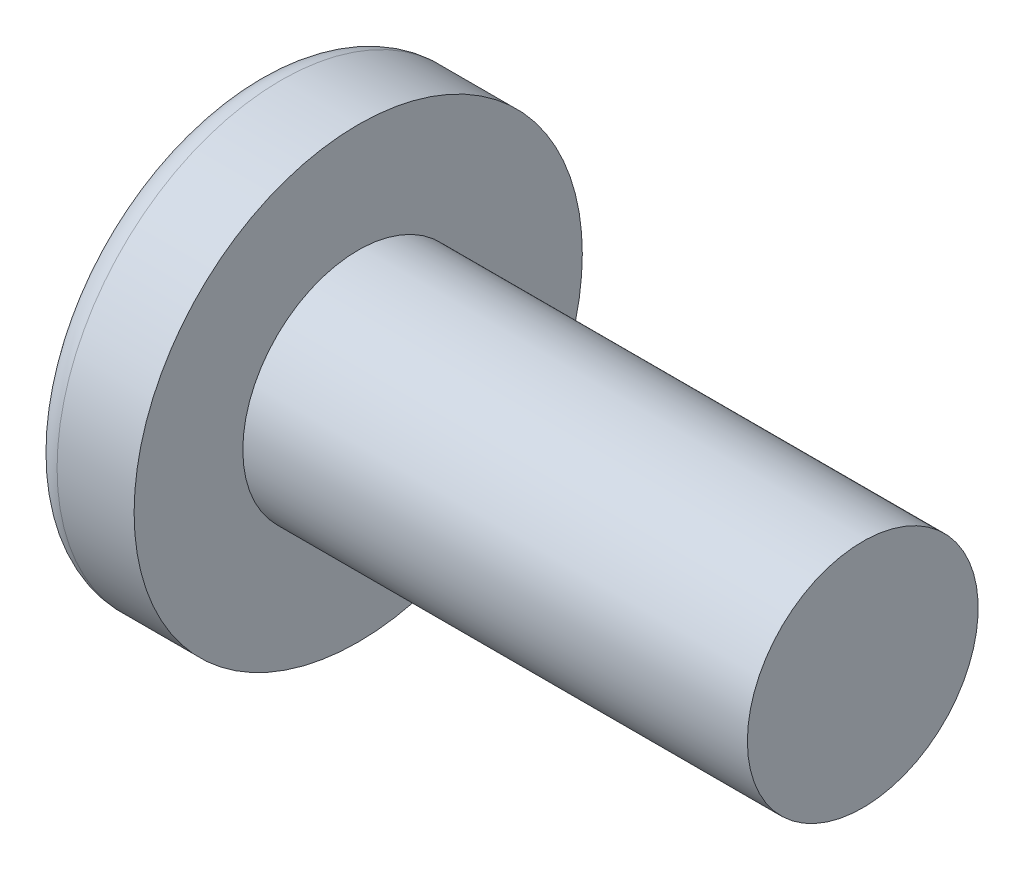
SolidWorks part; units mm, degrees
ref_plane "Plane1" through (0, 0, 0) normal (0, 0, 1) x (1, 0, 0)
ref_plane "Plane2" through (0, 0, 0) normal (0, 1, 0) x (1, 0, 0)
ref_plane "Plane3" through (0, 0, 0) normal (1, 0, 0) x (0, 0, -1)
sketch "BodySke" plane through (0, 0, 0) normal (0, 0, 1) x (1, 0, 0)
  line L0 (1.5748, 1.0922) -> (1.5748, 2.1209)
  line L1 (1.8021, 6.35) -> (1.8021, -3.175) construction
  line L2 (-25.4, 0) -> (127, 0) construction
  line L3 (6.35, 0) -> (0, 0)
  line L4 (1.5748, 1.0922) -> (6.35, 1.0922)
  line L5 (6.35, 1.0922) -> (6.35, 0)
  line L6 (0.8457, 2.1209) -> (1.5748, 2.1209)
  line L7 (1.5748, -1.0922) -> (6.35, -1.0922) construction
  line L8 (1.5748, 6.35) -> (1.5748, -3.175) construction
  arc A0 (0.6381, 2.0132) -> (0, 0) centre (3.495, 0) ccw
  arc A2 (0.6381, 2.0132) -> (0.8457, 2.1209) centre (0.8457, 1.8669) cw
  dimension "Head_fillet_rad" = 0.254
  dimension "Head_crown_rad" = 3.495
  dimension "Head_ht" = 1.5748
  dimension "Diameter" = 2.1844
  dimension "Length" = 4.7752
  dimension "Head_dia" = 4.2418
  dimension "Advance" = 0.4547
  dimension "Thread_nom" = 4.7752
revolve "Base-Revolve" add sketch "BodySke" angle 360 about L2
sketch "Sketch3" plane through (0, 0, 0) normal (1, 0, 0) x (0, 0, -1)
  line L0 (0.3429, -1.3843) -> (-0.3429, -1.3843)
  line L1 (0.3429, -1.3843) -> (0.3429, 1.3843)
  line L2 (-0.3429, 1.3843) -> (0.3429, 1.3843)
  line L3 (-0.3429, 1.3843) -> (-0.3429, -1.3843)
  dimension "D1" = 1.3843
  dimension "Cross_dia" = 2.7686
  dimension "D2" = 0.3429
  dimension "Cross_width" = 0.6858
ref_plane "Plane4" through (1.4986, 0, 0) normal (1, 0, 0) x (0, 0, -1)
sketch "Sketch4" plane through (1.4986, 0, 0) normal (1, 0, 0) x (0, 0, -1)
  line L0 (0.1715, -0.1715) -> (-0.1715, -0.1715)
  line L1 (0.1715, -0.1715) -> (0.1714, 0.1714)
  line L2 (-0.1715, 0.1714) -> (0.1714, 0.1714)
  line L3 (-0.1715, 0.1714) -> (-0.1715, -0.1715)
  dimension "D1" = 0.3429
  dimension "D2" = 0.3429
  dimension "D3" = 0.1714
  dimension "D4" = 0.1714
loft "Cut-Loft1" cut profiles "Sketch3", "Sketch4"
pattern_circular "CirPattern1" count 2 every 90 about axis through (0, 0, 0) along (1, 0, 0) of "Cut-Loft1"
sketch "ThdSchSke" plane through (0, 0, 0) normal (0, 0, 1) x (1, 0, 0)
  line L0 (2.0295, -0.823) -> (1.8409, -1.0922)
  line L1 (2.0295, -0.823) -> (2.218, -1.0922)
  line L2 (2.218, -1.0922) -> (2.218, -1.3653)
  line L3 (-3.175, 0) -> (5.1513, 0) construction
  line L5 (2.218, -1.3653) -> (1.8409, -1.3653)
  line L6 (1.8409, -1.3653) -> (1.8409, -1.0922)
  dimension "Thread_minor" = 1.6459
  dimension "Diameter" = 2.1844
  dimension "Start" = 2.0295
  dimension "SideAngle" = 55
  dimension "VeeAngle" = 70
  dimension "Overcut" = 2.7305
revolve "ThreadSchematic" [suppressed] cut sketch "ThdSchSke" angle 360 about L3
pattern_linear "ThdSchPat" [suppressed]
equation "\"D1@Sketch3\" = \"Cross_dia@Sketch3\" / 2"
equation "\"D2@Sketch3\" = \"Cross_width@Sketch3\" / 2"
equation "\"D1@Sketch4\" = \"Cross_width@Sketch3\" *.5"
equation "\"D2@Sketch4\" = \"D1@Sketch4\""
equation "\"D3@Sketch4\" = \"D1@Sketch4\" / 2"
equation "\"D4@Sketch4\" = \"D2@Sketch4\" / 2"
equation "\"Thread_length@ThreadCosmetic\" = ((sgn( (\"Length@BodySke\" - \"Advance@BodySke\" ) - \"Thread_nom@BodySke\" )-1)*( (\"Length@BodySke\" - \"Advance@BodySke\" ) - \"Thread_nom@BodySke\" ))/-2+ \"Thread_nom@BodySke\""
equation "\"Thread_minor@ThdSchSke\" = \"Thread_minor@ThreadCosmetic\""
equation "\"Diameter@ThdSchSke\" = \"Diameter@BodySke\""
equation "\"Overcut@ThdSchSke\" = \"Diameter@BodySke\" * 1.25"
equation "\"Start@ThdSchSke\" = \"Head_ht@BodySke\" + \"Length@BodySke\" - \"Thread_length@ThreadCosmetic\"  '---Non-countersunk---"
equation "\"Num_threads@ThdSchPat\" = int( \"Thread_length@ThreadCosmetic\" / \"Advance@BodySke\" + 0.999 )  + 1"
equation "\"Advance@ThdSchPat\" = \"Thread_length@ThreadCosmetic\" /  (\"Num_threads@ThdSchPat\" - 1) 'relax it"
